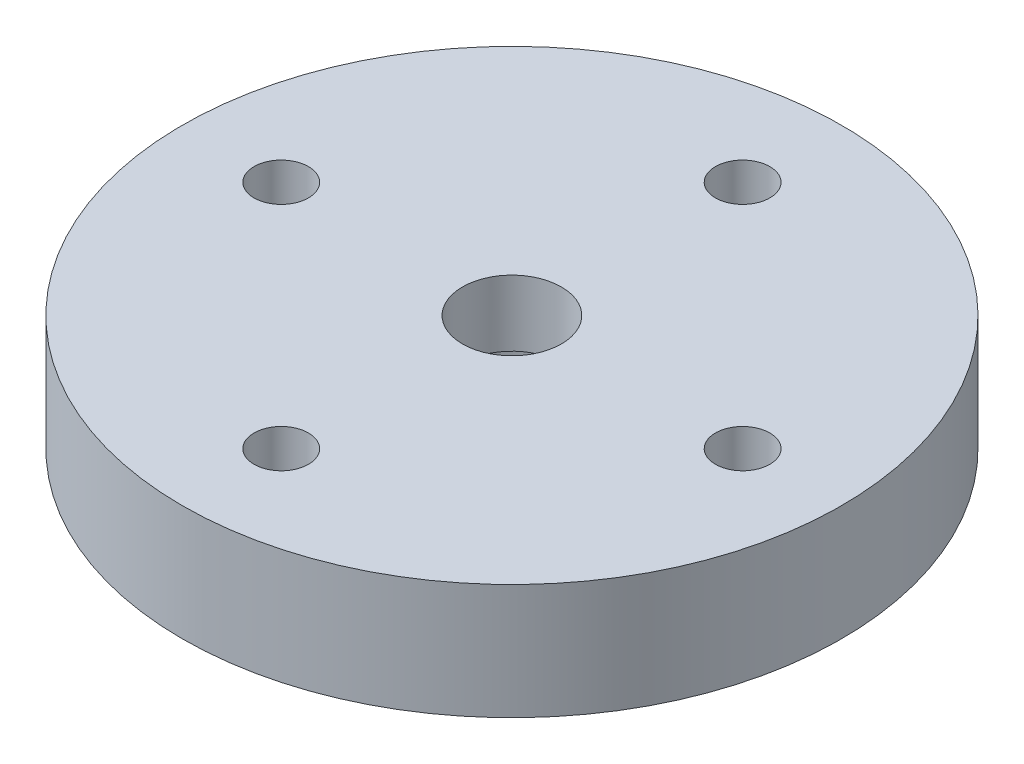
SolidWorks part; units mm, degrees
ref_plane "Front Plane" through (0, 0, 0) normal (0, 0, 1) x (1, 0, 0)
ref_plane "Top Plane" through (0, 0, 0) normal (0, 1, 0) x (1, 0, 0)
ref_plane "Right Plane" through (0, 0, 0) normal (1, 0, 0) x (0, 0, -1)
sketch "Sketch1" plane through (0, 0, 0) normal (0, 1, 0) x (1, 0, 0)
  line L0 (0, 0) -> (0, 7) construction
  line L1 (0, 0) -> (7, 0) construction
  line L2 (0, 0) -> (0, -7) construction
  line L3 (0, 0) -> (-7, 0) construction
  circle A0 centre (0, 0) radius 10
  circle A1 centre (0, 0) radius 1.5
  circle A2 centre (0, 7) radius 0.825
  circle A3 centre (7, 0) radius 0.825
  circle A4 centre (0, -7) radius 0.825
  circle A5 centre (-7, 0) radius 0.825
  point P15 (0, 0)
  dimension "D1" = 20
  dimension "D2" = 3
  dimension "D4" = 1.65
  dimension "D3" = 7
  dimension "D5" = 4
extrude "Boss-Extrude1" add sketch "Sketch1" along normal blind 3.5
sketch "Sketch2" plane through (0, 0, 0) normal (0, -1, 0) x (1, 0, 0)
  circle A0 centre (0, 0) radius 4.5
  circle A1 centre (0, 0) radius 1.5 construction
  circle A2 centre (0, 0) radius 1.5
  dimension "D1" = 9
extrude "Boss-Extrude2" add sketch "Sketch2" along normal blind 2
sketch "Sketch3" plane through (0, -2, 0) normal (0, -1, 0) x (1, 0, 0)
  circle A0 centre (0, 0) radius 3
  dimension "D1" = 6
extrude "Cut-Extrude1" cut sketch "Sketch3" against normal blind 3.5
chamfer "Chamfer1" distance 0.5 angle 45 1 edges at (0, -2, -3)
